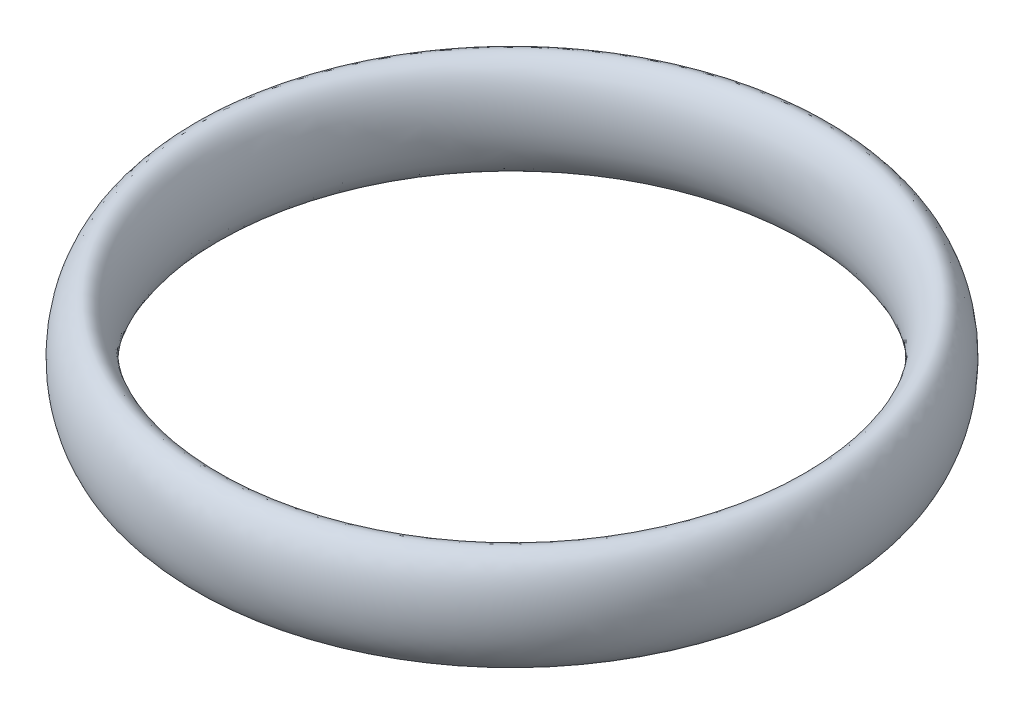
SolidWorks part; units mm, degrees
ref_plane "Plane1" through (0, 0, 0) normal (0, 0, 1) x (1, 0, 0)
ref_plane "Plane2" through (0, 0, 0) normal (0, 1, 0) x (1, 0, 0)
ref_plane "Plane3" through (0, 0, 0) normal (1, 0, 0) x (0, 0, -1)
sketch "Sketch1" plane through (0, 0, 0) normal (0, 0, 1) x (1, 0, 0)
  line L0 (0, 0) -> (0, 2.54) construction
  line L1 (7.5692, 2.54) -> (7.5692, 0) construction
  ellipse E0 centre (7.5692, 1.27) end of major axis (7.5692, 2.54) minor radius 0.635
  dimension "D1" = 2.54
  dimension "D2" = 1.27
  dimension "D3" = 6.9342
revolve "Body" add sketch "Sketch1" angle 360 about L0
